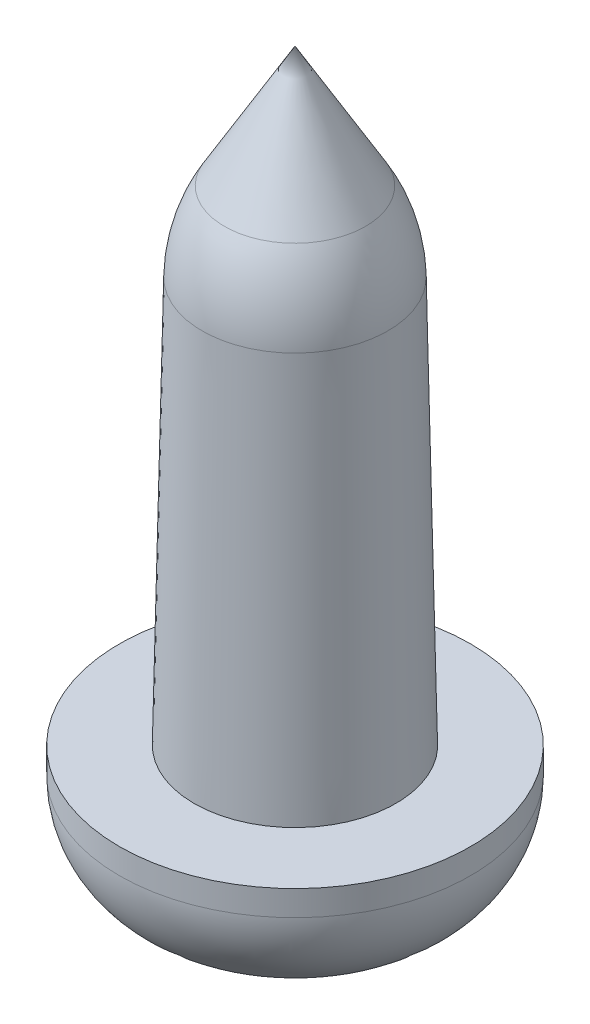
SolidWorks part; units mm, degrees
ref_plane "Face" through (0, 0, 0) normal (0, 0, 1) x (1, 0, 0)
ref_plane "Dessus" through (0, 0, 0) normal (0, 1, 0) x (1, 0, 0)
ref_plane "Droite" through (0, 0, 0) normal (1, 0, 0) x (0, 0, -1)
sketch "Esquisse1" plane through (0, 0, 0) normal (0, 0, 1) x (1, 0, 0)
  line L0 (0, 0) -> (0, 7.25) construction
  line L1 (0, 0) -> (0.74, 0)
  line L2 (1.74, 1) -> (1.74, 1.25)
  line L3 (0, 7.25) -> (0, 0)
  line L4 (0.9202, 5.2649) -> (1, 1.25)
  line L5 (1.74, 1.25) -> (1, 1.25)
  line L7 (0.6992, 6.0514) -> (0, 7.25)
  arc A0 (0.74, 0) -> (1.74, 1) centre (0.74, 1) ccw
  arc A1 (0.6992, 6.0514) -> (0.9202, 5.2649) centre (-0.7045, 5.2326) cw
  point P11 (1.74, 0)
  dimension "D1" = 1
  dimension "D2" = 1.74
  dimension "D3" = 1
  dimension "D4" = 1.25
  dimension "D5" = 6
revolve "Base-Révolution" add sketch "Esquisse1" angle 360 about L0
sketch "Esquisse2" plane through (0, 0, 0) normal (0, -1, 0) x (1, 0, 0)
  line L0 (0.35, -1.5) -> (0.35, -0.55)
  line L1 (-0.35, -1.5) -> (-0.35, -0.55)
  line L2 (1.5, 0.35) -> (0.55, 0.35)
  line L3 (1.5, -0.35) -> (0.55, -0.35)
  line L4 (1.5, 0.35) -> (1.5, -0.35)
  line L5 (0.35, -1.5) -> (-0.35, -1.5)
  line L6 (-1.5, -0.35) -> (-0.55, -0.35)
  line L7 (-1.5, 0.35) -> (-0.55, 0.35)
  line L8 (-1.5, -0.35) -> (-1.5, 0.35)
  line L9 (-0.35, 1.5) -> (-0.35, 0.55)
  line L10 (0.35, 1.5) -> (0.35, 0.55)
  line L11 (-0.35, 1.5) -> (0.35, 1.5)
  line L12 (0, 0) -> (-1.5, 0) construction
  line L13 (0, 0) -> (1.5, 0) construction
  arc A0 (-0.55, 0.35) -> (-0.35, 0.55) centre (-0.55, 0.55) ccw
  arc A1 (0.55, 0.35) -> (0.35, 0.55) centre (0.55, 0.55) cw
  arc A2 (0.55, -0.35) -> (0.35, -0.55) centre (0.55, -0.55) ccw
  arc A3 (-0.35, -0.55) -> (-0.55, -0.35) centre (-0.55, -0.55) ccw
  dimension "D1" = 0.2
  dimension "D2" = 0.7
  dimension "D3" = 3
extrude "Enlèv. mat.-Extru.1" cut sketch "Esquisse2" against normal blind 1 draft 12
